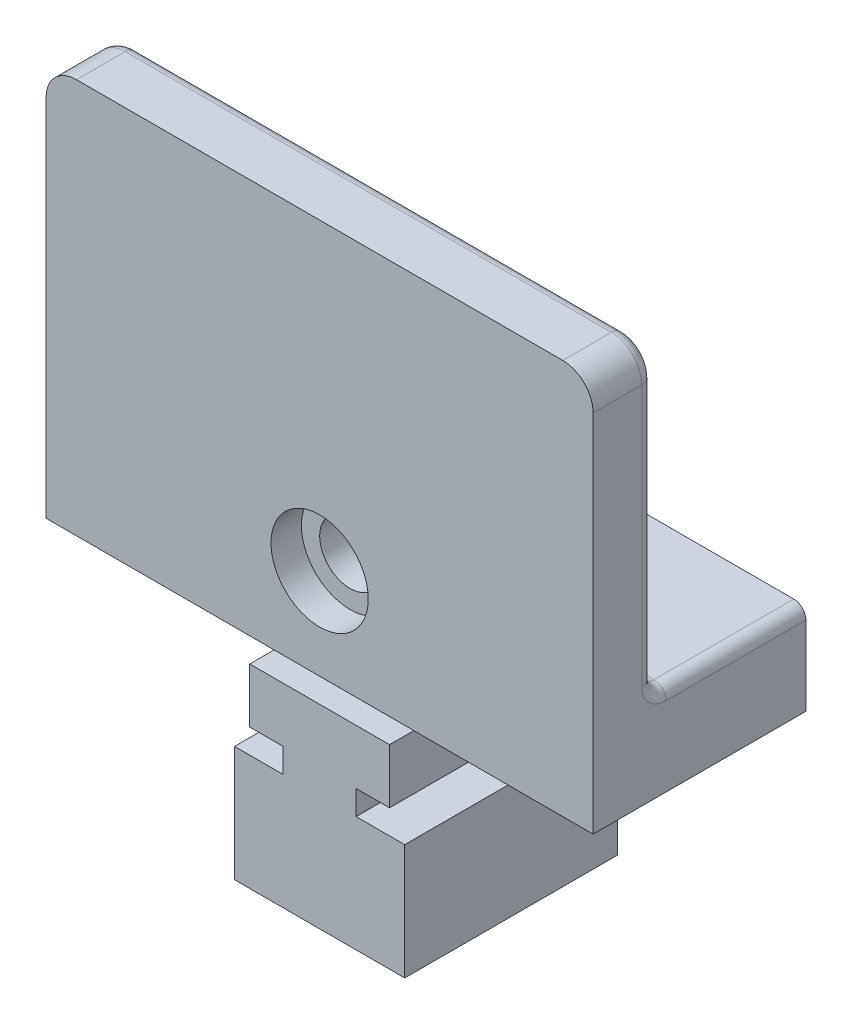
SolidWorks part; units mm, degrees
ref_plane "Front Plane" through (0, 0, 0) normal (0, 0, 1) x (1, 0, 0)
ref_plane "Top Plane" through (0, 0, 0) normal (0, 1, 0) x (1, 0, 0)
ref_plane "Right Plane" through (0, 0, 0) normal (1, 0, 0) x (0, 0, -1)
sketch "Sketch1" plane through (0, 0, 0) normal (0, 0, 1) x (1, 0, 0)
  line L1 (12.5, 40) -> (45, 40) construction
  line L3 (-45, 40) -> (-12.5, 40) construction
  line L4 (-45, 40) -> (-11.5, 40)
  line L5 (11.5, 40) -> (45, 40)
  line L6 (-12.5, 40) -> (12.5, 40) construction
  line L7 (0, 0) -> (0, 78.1051) construction
  line L8 (-11.5, 40) -> (-11.5, 27)
  line L9 (11.5, 40) -> (11.5, 27)
  line L10 (-11.5, 27) -> (-6, 27)
  line L11 (11.5, 27) -> (6, 27)
  line L12 (-6, 27) -> (-6, 23)
  line L13 (-18.8944, 55) -> (-43, 55)
  line L14 (-45, 53) -> (-45, 0)
  line L15 (-45, 0) -> (-16, 0)
  line L16 (-16, 0) -> (-16, 27)
  line L17 (-16, 27) -> (-12.5, 27)
  line L18 (-12.5, 27) -> (-12.5, 40)
  line L19 (-12.5, 40) -> (12.5, 40)
  line L20 (12.5, 40) -> (12.5, 27)
  line L21 (12.5, 27) -> (16, 27)
  line L22 (16, 27) -> (16, 0)
  line L23 (16, 0) -> (45, 0)
  line L24 (45, 0) -> (45, 53)
  line L25 (43, 55) -> (18.8944, 55)
  line L26 (-18.8944, 55) -> (-43, 55)
  line L27 (-45, 53) -> (-45, 40)
  line L28 (6, 27) -> (6, 23)
  line L29 (-6, 23) -> (-14, 23)
  line L30 (6, 23) -> (14, 23)
  line L31 (-14, 23) -> (-14, 4)
  line L32 (14, 23) -> (14, 4)
  line L33 (-14, 4) -> (14, 4)
  line L34 (-12.5, 27) -> (-12.5, 40) construction
  line L35 (-16, 0) -> (-16, 27) construction
  line L36 (-16, 0) -> (-40, 0) construction
  line L37 (45, 40) -> (45, 53)
  line L38 (43, 55) -> (18.8944, 55)
  line L39 (-16, 27) -> (-12.5, 27) construction
  arc A5 (-43, 55) -> (-45, 53) centre (-43, 53) ccw
  arc A6 (45, 53) -> (43, 55) centre (43, 53) ccw
  arc A7 (16.9056, 56.7895) -> (18.8944, 55) centre (18.8944, 57) ccw
  arc A8 (16.9056, 56.7895) -> (-16.9056, 56.7895) centre (0, 55) ccw
  arc A9 (-18.8944, 55) -> (-16.9056, 56.7895) centre (-18.8944, 57) ccw
  arc A10 (-43, 55) -> (-45, 53) centre (-43, 53) ccw
  arc A11 (45, 53) -> (43, 55) centre (43, 53) ccw
  arc A12 (16.9056, 56.7895) -> (18.8944, 55) centre (18.8944, 57) ccw
  arc A13 (16.9056, 56.7895) -> (-16.9056, 56.7895) centre (0, 55) ccw
  arc A14 (-18.8944, 55) -> (-16.9056, 56.7895) centre (-18.8944, 57) ccw
  point P44 (0, 4)
  dimension "D2" = 1
  dimension "D3" = 2
  dimension "D4" = 4
  dimension "D5" = 10
  dimension "D6" = 4
  dimension "D1" = 0
extrude "Boss-Extrude1" add sketch "Sketch1" along normal blind 25
sketch "Sketch2" plane through (0, 0, 25) normal (0, 0, 1) x (1, 0, 0)
  line L6 (-45, 100) -> (-45, 40)
  line L7 (40, 105) -> (-40, 105)
  line L8 (45, 40) -> (45, 100)
  line L9 (12.5, 40) -> (45, 40)
  line L10 (-12.5, 40) -> (12.5, 40)
  line L11 (-45, 40) -> (-12.5, 40)
  line L12 (-45, 100) -> (-45, 40)
  line L13 (40, 105) -> (-40, 105)
  line L14 (45, 40) -> (45, 100)
  line L15 (12.5, 40) -> (45, 40)
  line L16 (-12.5, 40) -> (12.5, 40)
  line L17 (-45, 40) -> (-12.5, 40)
  arc A2 (-40, 105) -> (-45, 100) centre (-40, 100) ccw
  arc A3 (45, 100) -> (40, 105) centre (40, 100) ccw
  arc A4 (-40, 105) -> (-45, 100) centre (-40, 100) ccw
  arc A5 (45, 100) -> (40, 105) centre (40, 100) ccw
  dimension "D1" = 0
extrude "Boss-Extrude2" add sketch "Sketch2" along normal blind 10
sketch "Sketch3" plane through (0, 0, 0) normal (0, 0, -1) x (-1, 0, 0)
  circle A2 centre (0, 55) radius 5
  circle A3 centre (0, 55) radius 5
  dimension "D1" = 2
extrude "Cut-Extrude1" cut sketch "Sketch3" against normal through all
fillet "Fillet1" radius 2 12 edges at (43.5355, 103.5355, 25) (-43.5355, 103.5355, 25) (30.9472, 55, 25) (17.5567, 55.5132, 25) (-30.9472, 55, 25) (-17.5567, 55.5132, 25) (0, 105, 25) (0, 72, 25)
sketch "Sketch4" plane through (0, 0, 35) normal (0, 0, 1) x (1, 0, 0)
  circle A2 centre (0, 55) radius 8
  circle A3 centre (0, 55) radius 8
  dimension "D1" = 3
extrude "Cut-Extrude2" cut sketch "Sketch4" against normal blind 5
sketch "Sketch5" plane through (0, 0, 25) normal (0, 0, 1) x (1, 0, 0)
  line L2 (-11.5, 36) -> (11.5, 36)
  line L3 (-11.5, 36) -> (11.5, 36)
  line L12 (11.5, 40) -> (-11.5, 40)
  line L13 (-11.5, 40) -> (-11.5, 27)
  line L14 (-11.5, 27) -> (-6, 27)
  line L15 (-6, 27) -> (-6, 23)
  line L16 (-6, 23) -> (-14, 23)
  line L17 (-14, 23) -> (-14, 4)
  line L18 (-14, 4) -> (14, 4)
  line L19 (14, 4) -> (14, 23)
  line L20 (14, 23) -> (6, 23)
  line L21 (6, 23) -> (6, 27)
  line L22 (6, 27) -> (11.5, 27)
  line L23 (11.5, 27) -> (11.5, 40)
  line L25 (-11.5, 36) -> (-11.5, 27)
  line L26 (-11.5, 27) -> (-6, 27)
  line L27 (-6, 27) -> (-6, 23)
  line L28 (-6, 23) -> (-14, 23)
  line L29 (-14, 23) -> (-14, 4)
  line L30 (-14, 4) -> (14, 4)
  line L31 (14, 4) -> (14, 23)
  line L32 (14, 23) -> (6, 23)
  line L33 (6, 23) -> (6, 27)
  line L34 (6, 27) -> (11.5, 27)
  line L35 (11.5, 27) -> (11.5, 36)
  dimension "D1" = 0
  dimension "D2" = 4
extrude "Boss-Extrude3" add sketch "Sketch5" along normal up to surface (10 mm away)
